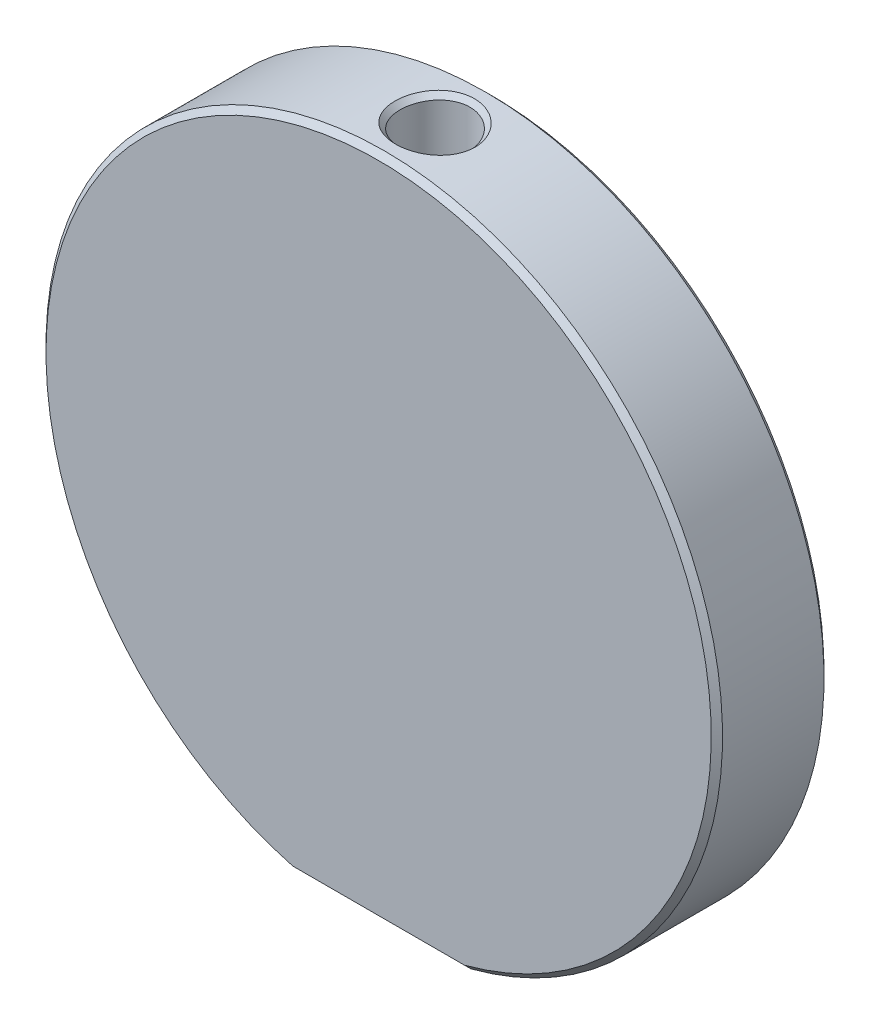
SolidWorks part; units mm, degrees
ref_plane "Спереди" through (0, 0, 0) normal (0, 0, 1) x (1, 0, 0)
ref_plane "Сверху" through (0, 0, 0) normal (0, 1, 0) x (1, 0, 0)
ref_plane "Справа" through (0, 0, 0) normal (1, 0, 0) x (0, 0, -1)
sketch "Эскиз1" plane through (0, 0, 0) normal (0, 0, 1) x (1, 0, 0)
  line L1 (-7.6811, -29) -> (7.6811, -29)
  arc A0 (7.6811, -29) -> (-7.6811, -29) centre (0, 0) ccw
  dimension "D1" = 60
  dimension "D2" = 29
extrude "Бобышка-Вытянуть1" add sketch "Эскиз1" along normal blind 10
sketch "Эскиз2" plane through (0, 0, 0) normal (0, 1, 0) x (1, 0, 0)
  circle A0 centre (0, -5) radius 3.1
  dimension "D1" = 6.2
  dimension "D2" = 5
extrude "Вырез-Вытянуть1" cut sketch "Эскиз2" against normal mid plane 60
chamfer "Фаска1" distance 0.5 angle 45 6 edges at (0.6944, 29.992, 1.9788) (0, -29, 8.1) (0, -29, 0) (0, 30, 0) (0, -29, 10) (0, 30, 10)
